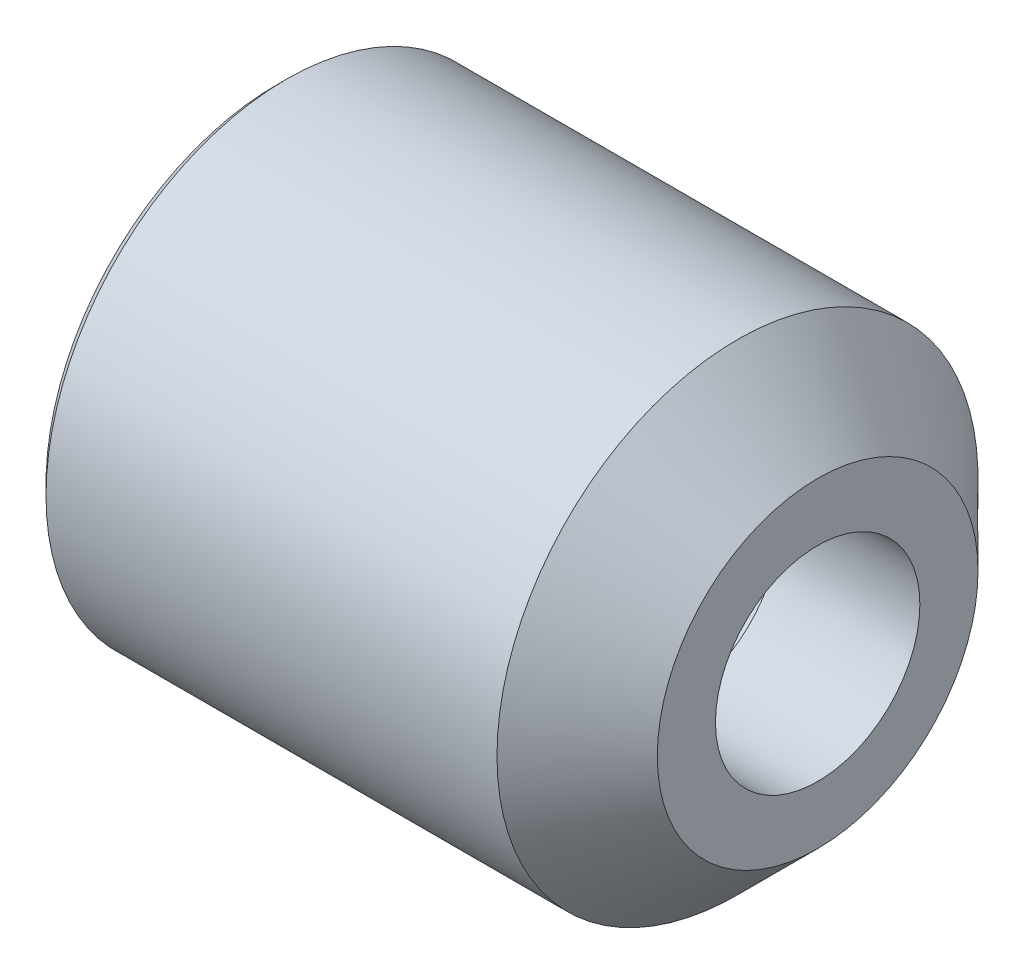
SolidWorks part; units mm, degrees
ref_plane "Plan de face" through (0, 0, 0) normal (0, 0, 1) x (1, 0, 0)
ref_plane "Plan de dessus" through (0, 0, 0) normal (0, 1, 0) x (1, 0, 0)
ref_plane "Plan de droite" through (0, 0, 0) normal (1, 0, 0) x (0, 0, -1)
sketch "Esquisse1" plane through (0, 0, 0) normal (0, 0, 1) x (1, 0, 0)
  line L0 (-60.9367, 0) -> (61.3728, 0) construction
  line L2 (0, 12) -> (27, 12)
  line L3 (0, 12) -> (0, 8.6)
  line L4 (0, 8.6) -> (20, 8.6)
  line L7 (27, 12) -> (27, 5.1)
  line L8 (27, 5.1) -> (20, 5.1)
  line L9 (20, 8.6) -> (20, 5.1)
  dimension "D1" = 27
  dimension "D2" = 5.1
  dimension "D3" = 8.6
  dimension "D4" = 20
  dimension "D5" = 12
revolve "Révolution1" add sketch "Esquisse1" angle 360 about L0
chamfer "Chanfrein1" distance 4 angle 45 1 edges at (27, 0, 12)
chamfer "Chanfrein2" distance 0.5 angle 45 1 edges at (0, 0, 12)
